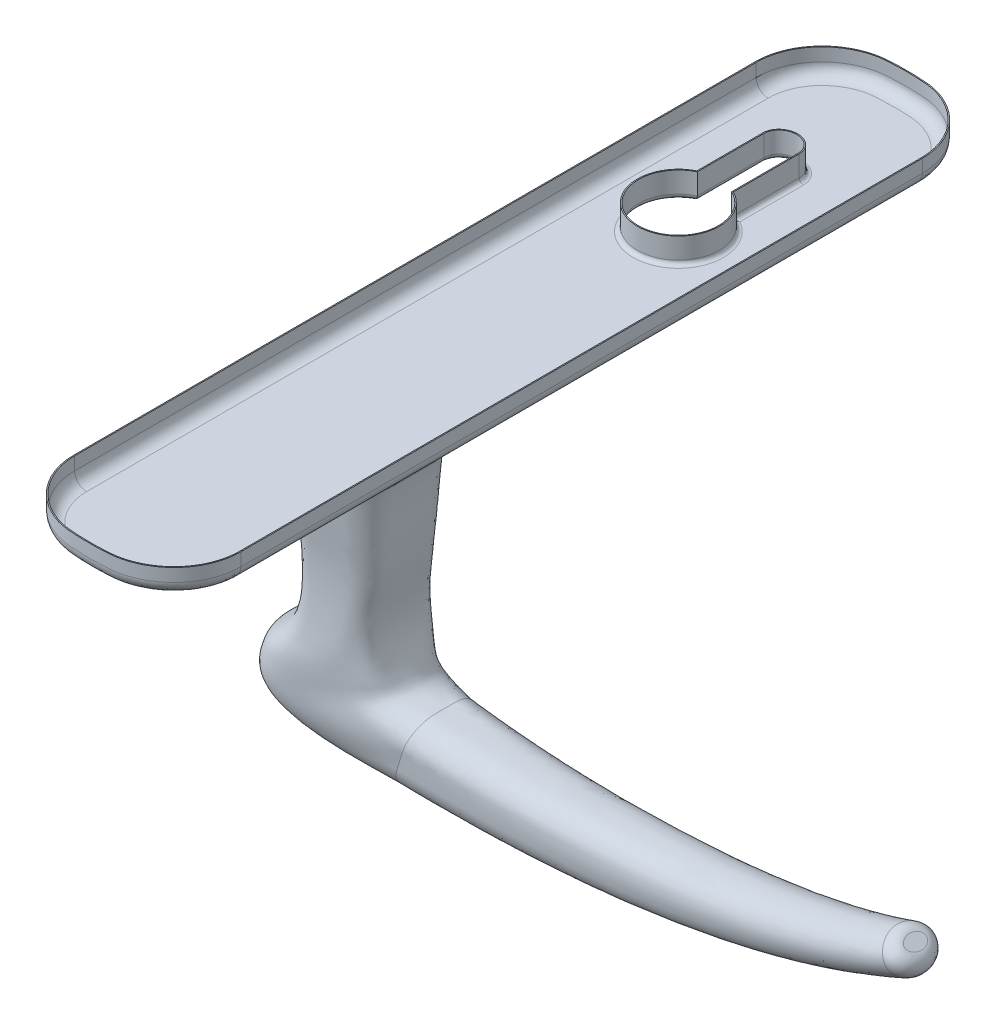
SolidWorks part; units mm, degrees
ref_plane "Front Plane" through (0, 0, 0) normal (0, 0, 1) x (1, 0, 0)
ref_plane "Top Plane" through (0, 0, 0) normal (0, 1, 0) x (1, 0, 0)
ref_plane "Right Plane" through (0, 0, 0) normal (1, 0, 0) x (0, 0, -1)
sketch "Sketch1" plane through (0, 0, 0) normal (0, 1, 0) x (1, 0, 0)
  line L0 (-11.1664, -30) -> (120.3158, -30) construction
ref_plane "Plane1" through (0, 0, 30) normal (0, 0, 1) x (1, 0, 0)
ref_plane "Plane2" through (0, -32, 0) normal (0, 1, 0) x (-1, 0, 0)
ref_plane "Plane3" through (0, -43, 0) normal (0, 1, 0) x (-1, 0, 0)
ref_plane "Plane4" through (0, -49, 0) normal (0, 1, 0) x (-1, 0, 0)
sketch3d "3DSketch219"
  line L0 (13.3868, -65.1849, 30) -> (-11.1664, -69.2788, 30)
sketch3d "3DSketch220"
  line L0 (15.9624, -81.7267, 30) -> (19.8646, -68.794, 30)
sketch3d "3DSketch221"
  line L0 (109.6484, -62.1121, 30) -> (112.8958, -64.571, 30)
ref_plane "Plane5" through (10.0648, 13.2922, 0) normal (-0.6037, -0.7972, 0) x (0.7972, -0.6037, 0)
sketch "Sketch7" plane through (10.0648, 13.2922, 0) normal (-0.6037, -0.7972, 0) x (0.7972, -0.6037, 0)
  ellipse E0 centre (126.9474, 30) end of major axis (126.9525, 34.4849) minor radius 2.0366 construction
  ellipse E1 centre (126.9474, 30) end of major axis (126.9525, 34.4849) minor radius 4.1826
ref_plane "Plane6" through (10.9367, -65.5935, 0) normal (0.1645, -0.9864, 0) x (-0.973, -0.1622, -0.1645)
ref_plane "Plane7" through (37.2326, -11.2345, 0) normal (0.9574, -0.2889, 0) x (0, 0, -1)
sketch "Sketch8" plane through (0, -32, 0) normal (0, 1, 0) x (-1, 0, 0)
  line L0 (11.1664, 30) -> (-120.3158, 30) construction
  line L1 (-8.8277, 21.1881) -> (-1.0318, 21.1881)
  line L2 (-13.8277, 26.1881) -> (-13.8277, 33.8119)
  line L3 (-8.8277, 38.8119) -> (-1.0318, 38.8119)
  line L4 (3.9682, 26.1881) -> (3.9682, 33.8119)
  line L5 (-13.8277, 21.1881) -> (3.9682, 38.8119) construction
  line L6 (-13.8277, 38.8119) -> (3.9682, 21.1881) construction
  arc A0 (-1.0318, 21.1881) -> (3.9682, 26.1881) centre (-1.0318, 26.1881) ccw
  arc A1 (-8.8277, 21.1881) -> (-13.8277, 26.1881) centre (-8.8277, 26.1881) cw
  arc A2 (-1.0318, 38.8119) -> (3.9682, 33.8119) centre (-1.0318, 33.8119) cw
  arc A3 (-13.8277, 33.8119) -> (-8.8277, 38.8119) centre (-8.8277, 33.8119) cw
  point P0 (-4.9297, 30)
  dimension "D1" = 5
sketch "Sketch9" plane through (0, -43, 0) normal (0, 1, 0) x (-1, 0, 0)
  line L8 (-12.8277, 33.8119) -> (-12.8277, 26.1881)
  line L9 (-8.8277, 22.1881) -> (-1.0318, 22.1881)
  line L10 (2.9682, 26.1881) -> (2.9682, 33.8119)
  line L11 (-1.0318, 37.8119) -> (-8.8277, 37.8119)
  line L12 (-12.8277, 33.8119) -> (-12.8277, 26.1881)
  line L13 (-8.8277, 22.1881) -> (-1.0318, 22.1881)
  line L14 (2.9682, 26.1881) -> (2.9682, 33.8119)
  line L15 (-1.0318, 37.8119) -> (-8.8277, 37.8119)
  arc A8 (-12.8277, 26.1881) -> (-8.8277, 22.1881) centre (-8.8277, 26.1881) ccw
  arc A9 (-1.0318, 22.1881) -> (2.9682, 26.1881) centre (-1.0318, 26.1881) ccw
  arc A10 (2.9682, 33.8119) -> (-1.0318, 37.8119) centre (-1.0318, 33.8119) ccw
  arc A11 (-8.8277, 37.8119) -> (-12.8277, 33.8119) centre (-8.8277, 33.8119) ccw
  arc A12 (-12.8277, 26.1881) -> (-8.8277, 22.1881) centre (-8.8277, 26.1881) ccw
  arc A13 (-1.0318, 22.1881) -> (2.9682, 26.1881) centre (-1.0318, 26.1881) ccw
  arc A14 (2.9682, 33.8119) -> (-1.0318, 37.8119) centre (-1.0318, 33.8119) ccw
  arc A15 (-8.8277, 37.8119) -> (-12.8277, 33.8119) centre (-8.8277, 33.8119) ccw
  dimension "D1" = 1
sketch "Sketch10" plane through (0, -49, 0) normal (0, 1, 0) x (-1, 0, 0)
  line L8 (-1.0318, 37.3119) -> (-8.8277, 37.3119)
  line L9 (2.4682, 26.1881) -> (2.4682, 33.8119)
  line L10 (-8.8277, 22.6881) -> (-1.0318, 22.6881)
  line L11 (-12.3277, 33.8119) -> (-12.3277, 26.1881)
  line L12 (-1.0318, 37.3119) -> (-8.8277, 37.3119)
  line L13 (2.4682, 26.1881) -> (2.4682, 33.8119)
  line L14 (-8.8277, 22.6881) -> (-1.0318, 22.6881)
  line L15 (-12.3277, 33.8119) -> (-12.3277, 26.1881)
  arc A8 (2.4682, 33.8119) -> (-1.0318, 37.3119) centre (-1.0318, 33.8119) ccw
  arc A9 (-1.0318, 22.6881) -> (2.4682, 26.1881) centre (-1.0318, 26.1881) ccw
  arc A10 (-12.3277, 26.1881) -> (-8.8277, 22.6881) centre (-8.8277, 26.1881) ccw
  arc A11 (-8.8277, 37.3119) -> (-12.3277, 33.8119) centre (-8.8277, 33.8119) ccw
  arc A12 (2.4682, 33.8119) -> (-1.0318, 37.3119) centre (-1.0318, 33.8119) ccw
  arc A13 (-1.0318, 22.6881) -> (2.4682, 26.1881) centre (-1.0318, 26.1881) ccw
  arc A14 (-12.3277, 26.1881) -> (-8.8277, 22.6881) centre (-8.8277, 26.1881) ccw
  arc A15 (-8.8277, 37.3119) -> (-12.3277, 33.8119) centre (-8.8277, 33.8119) ccw
  dimension "D1" = 0.5
sketch "Sketch11" plane through (10.9367, -65.5935, 0) normal (0.1645, -0.9864, 0) x (-0.973, -0.1622, -0.1645)
  spline S0 degree 3 poles (0.6777, -21.9803) (7.1096, -21.772) (15.9265, -23.8582) (18.6547, -33.9376) (12.1735, -41.8127) (3.557, -40.7206) (-2.4193, -38.543) (-7.6762, -35.8212) (-7.6395, -31.8332) (-7.4527, -29.1757) (-6.7453, -26.1554) (-4.7253, -22.607) (0.6777, -21.9803) (7.1096, -21.772) (15.9265, -23.8582) knots -0.215339 -0.156562 -0.093931 0 0.131233 0.248298 0.380384 0.493784 0.587715 0.669336 0.710103 0.747382 0.784661 0.843438 0.906069 1 1.131233 1.248298 1.380384 only from (6.4097, -22.0662) to (6.4097, -22.0662)
sketch "Sketch12" plane through (37.2326, -11.2345, 0) normal (0.9574, -0.2889, 0) x (0, 0, -1)
  line L1 (-31.8329, -73.4957) -> (-28.1671, -73.4957)
  line L2 (-36.8329, -68.4957) -> (-36.8329, -65.1227)
  line L3 (-31.8329, -60.1227) -> (-28.1671, -60.1227)
  line L4 (-23.1671, -68.4957) -> (-23.1671, -65.1227)
  line L5 (-36.8329, -73.4957) -> (-23.1671, -60.1227) construction
  line L6 (-36.8329, -60.1227) -> (-23.1671, -73.4957) construction
  arc A0 (-31.8329, -73.4957) -> (-36.8329, -68.4957) centre (-31.8329, -68.4957) cw
  arc A1 (-28.1671, -73.4957) -> (-23.1671, -68.4957) centre (-28.1671, -68.4957) ccw
  arc A2 (-28.1671, -60.1227) -> (-23.1671, -65.1227) centre (-28.1671, -65.1227) cw
  arc A3 (-36.8329, -65.1227) -> (-31.8329, -60.1227) centre (-31.8329, -65.1227) cw
  point P0 (-30, -66.8092)
sketch "Sketch15" plane through (0, 0, 30) normal (0, 0, 1) x (1, 0, 0)
  parabola Q1
  spline S1 degree 3 poles (-3.9682, -32) (-3.6064, -34.8743) (-2.7755, -45.6439) (-1.192, -63.2966) (-9.1217, -64.9671) (-12.5339, -72.058) (-14.8813, -80.5637) (16.0015, -81.5969) knots 0 0 0 0 0.164502 0.220065 0.62066 0.703661 1 1 1 1
sketch "Sketch16" plane through (0, 0, 30) normal (0, 0, 1) x (1, 0, 0)
  spline S2 degree 3 poles (13.8277, -32) (12.9519, -35.7644) (13.1246, -49.8134) (10.1263, -59.3206) (14.6388, -67.4629) (15.3082, -68.0401) (19.8646, -68.794) knots 0 0 0 0 0.40351 0.773564 0.833213 1 1 1 1
  spline S3 degree 3 poles (19.8646, -68.794) (36.5077, -70.8049) (78.1373, -72.1337) (107.9376, -60.8167) knots 0 0 0 0 1 1 1 1
other "Boundary-Surface5"
surface "Surface-Fill3"
surface "Surface-Fill4"
fillet "Fillet4" radius 1 8 edges
fillet "Fillet5" radius 2.5 1 edges at (110.4077, -62.687, 25.6682)
sketch "Sketch17" plane through (0, -32, 0) normal (0, 1, 0) x (1, 0, 0)
  line L0 (16.0513, -65.419) -> (16.0513, 65.419)
  line L1 (16.0513, 65.419) -> (15.6923, 68.4013) construction
  line L2 (15.6923, 68.4013) -> (14.6645, 71.1543) construction
  line L3 (14.6645, 71.1543) -> (13.0529, 73.5822) construction
  line L4 (13.0529, 73.5822) -> (10.9407, 75.6066) construction
  line L5 (10.9407, 75.6066) -> (8.4099, 77.1494) construction
  line L6 (8.4099, 77.1494) -> (5.5428, 78.1326) construction
  line L7 (5.5428, 78.1326) -> (2.4362, 78.4761) construction
  line L8 (2.4362, 78.4761) -> (-2.4363, 78.4761) construction
  line L9 (-2.4363, 78.4761) -> (-5.5428, 78.1326) construction
  line L10 (-5.5428, 78.1326) -> (-8.41, 77.1494) construction
  line L11 (-8.41, 77.1494) -> (-10.9407, 75.6065) construction
  line L12 (-10.9407, 75.6065) -> (-13.053, 73.5822) construction
  line L13 (-13.053, 73.5822) -> (-14.6645, 71.1543) construction
  line L14 (-14.6645, 71.1543) -> (-15.6923, 68.4013) construction
  line L15 (-15.6923, 68.4013) -> (-16.0514, 65.419) construction
  line L16 (-16.0514, 65.419) -> (-16.0514, -65.419)
  line L17 (-16.0514, -65.419) -> (-15.6923, -68.4013) construction
  line L18 (-15.6923, -68.4013) -> (-14.6645, -71.1543) construction
  line L19 (-14.6645, -71.1543) -> (-13.053, -73.5822) construction
  line L20 (-13.053, -73.5822) -> (-10.9407, -75.6065) construction
  line L21 (-10.9407, -75.6065) -> (-8.41, -77.1493) construction
  line L22 (-8.41, -77.1493) -> (-5.5428, -78.1326) construction
  line L23 (-5.5428, -78.1326) -> (-2.4363, -78.4761) construction
  line L24 (-2.4363, -78.4761) -> (2.4362, -78.4761) construction
  line L25 (2.4362, -78.4761) -> (5.5428, -78.1326) construction
  line L26 (5.5428, -78.1326) -> (8.4099, -77.1493) construction
  line L27 (8.4099, -77.1493) -> (10.9407, -75.6065) construction
  line L28 (10.9407, -75.6065) -> (13.0529, -73.5822) construction
  line L29 (13.0529, -73.5822) -> (14.6645, -71.1542) construction
  line L30 (14.6645, -71.1542) -> (15.6923, -68.4013) construction
  line L31 (15.6923, -68.4013) -> (16.0513, -65.419) construction
  spline S0 degree 3 poles (-16.0514, -65.419) (-16.0594, -67.407) (-15.3283, -70.3586) (-13.1329, -73.6542) (-10.9956, -75.7004) (-8.4359, -77.2519) (-5.5375, -78.2724) (-1.8501, -78.5511) (1.8501, -78.5511) (5.5374, -78.2724) (8.4359, -77.2519) (10.9956, -75.7004) (13.1329, -73.6542) (15.3282, -70.3585) (16.0594, -67.407) (16.0513, -65.419) knots 0 0 0 0 0.127308 0.189737 0.252414 0.315912 0.380849 0.447807 0.552193 0.619151 0.684088 0.747586 0.810264 0.872694 1 1 1 1
  spline S1 degree 3 poles (-16.0514, 65.419) (-16.0594, 67.407) (-15.3283, 70.3586) (-13.1329, 73.6542) (-10.9956, 75.7004) (-8.436, 77.252) (-5.5375, 78.2724) (-1.8501, 78.5511) (1.8501, 78.5511) (5.5374, 78.2724) (8.4359, 77.252) (10.9956, 75.7005) (13.1328, 73.6542) (15.3283, 70.3586) (16.0593, 67.407) (16.0513, 65.419) knots 0 0 0 0 0.127308 0.189736 0.252414 0.315913 0.380849 0.447807 0.552193 0.619151 0.684087 0.747585 0.810264 0.872692 1 1 1 1
extrude "Boss-Extrude1" add sketch "Sketch17" along normal blind 5
sketch "Sketch18" plane through (0, -32, 0) normal (0, -1, 0) x (1, 0, 0)
  line L305 (-3.3002, -41.555) -> (-3.2901, -54.3409)
  line L306 (3.2919, -54.3409) -> (3.3002, -41.555)
  arc A1 (3.3002, -41.555) -> (-3.3002, -41.555) centre (0, -34.6286) ccw
  ellipse E1 centre (0.0009, -54.3409) end of major axis (3.2915, -54.3952) minor radius 2.9733 (-3.2901, -54.3409) -> (3.2919, -54.3409) ccw
extrude "Cut-Extrude1" cut sketch "Sketch18" against normal blind 5
fillet "Fillet6" radius 2.5 4 edges at (16.0513, -32, 0) (-16.0514, -32, 0)
fillet "Fillet7" radius 1 4 edges at (3.296, -32, -47.948) (0.0119, -32, -57.3143) (-3.2952, -32, -47.948) (0, -32, -26.9562)
shell "Shell1" thickness 0.2
